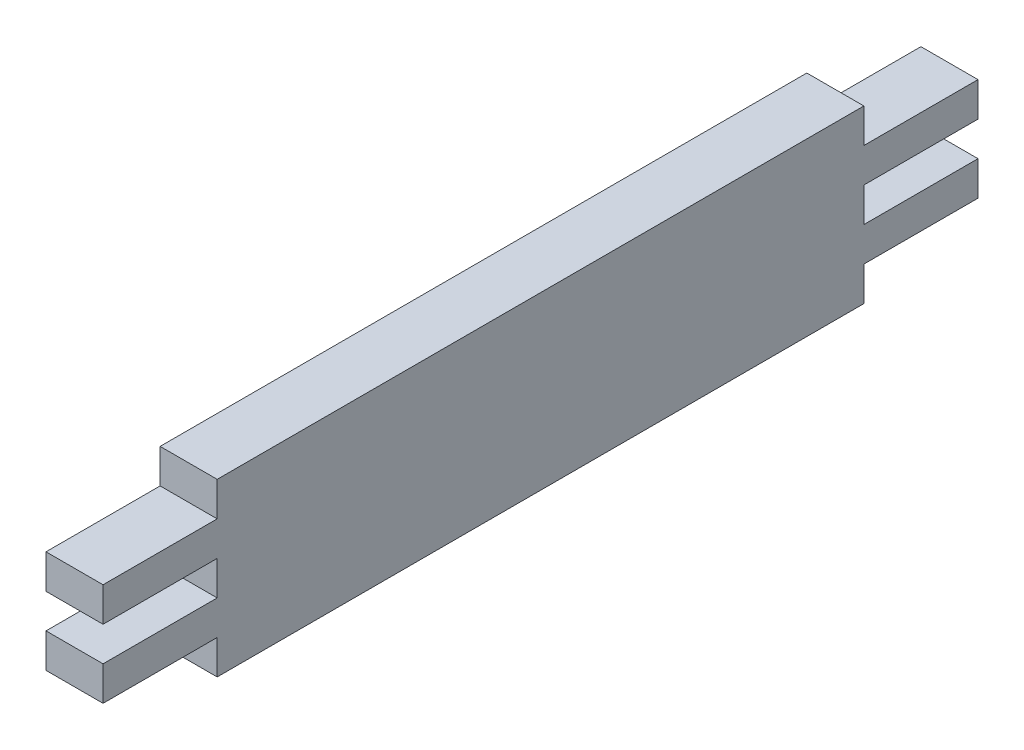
SolidWorks part; units mm, degrees
ref_plane "Front Plane" through (0, 0, 0) normal (0, 0, 1) x (1, 0, 0)
ref_plane "Top Plane" through (0, 0, 0) normal (0, 1, 0) x (1, 0, 0)
ref_plane "Right Plane" through (0, 0, 0) normal (1, 0, 0) x (0, 0, -1)
sketch "Sketch1" plane through (0, 0, 0) normal (1, 0, 0) x (0, 0, -1)
  line L1 (-23, -4.5) -> (23, -4.5)
  line L2 (-23, -4.5) -> (-23, 4.5)
  line L3 (-23, 4.5) -> (23, 4.5)
  line L4 (23, -4.5) -> (23, 4.5)
  line L5 (-23, -4.5) -> (23, 4.5) construction
  line L6 (-23, 4.5) -> (23, -4.5) construction
  point P0 (0, 0)
  dimension "D1" = 9
  dimension "D2" = 46
extrude "Boss-Extrude1" add sketch "Sketch1" along normal blind 3
sketch "Sketch2" plane through (0, 0, 0) normal (-1, 0, 0) x (0, 0, 1)
  line L0 (-23, -4.5) -> (-23, 4.5) construction
  line L1 (-23, 4.5) -> (-17, 4.5)
  line L2 (-23, 4.5) -> (-23, 2.7)
  line L3 (-23, 2.7) -> (-17, 2.7)
  line L4 (-17, 4.5) -> (-17, 2.7)
  line L5 (-23, 4.5) -> (23, 4.5) construction
  line L6 (-23, 0.9) -> (-17, 0.9)
  line L7 (-23, 0.9) -> (-23, -0.9)
  line L8 (-23, -0.9) -> (-17, -0.9)
  line L9 (-17, 0.9) -> (-17, -0.9)
  line L10 (-23, -2.7) -> (-17, -2.7)
  line L11 (-23, -2.7) -> (-23, -4.5)
  line L12 (-23, -4.5) -> (-17, -4.5)
  line L13 (-17, -2.7) -> (-17, -4.5)
  line L14 (17, 4.5) -> (23, 4.5)
  line L15 (17, 4.5) -> (17, 2.7)
  line L16 (17, 2.7) -> (23, 2.7)
  line L17 (23, 4.5) -> (23, 2.7)
  line L18 (17, 0.9) -> (23, 0.9)
  line L19 (17, 0.9) -> (17, -0.9)
  line L20 (17, -0.9) -> (23, -0.9)
  line L21 (23, 0.9) -> (23, -0.9)
  line L22 (17, -2.7) -> (23, -2.7)
  line L23 (17, -2.7) -> (17, -4.5)
  line L24 (17, -4.5) -> (23, -4.5)
  line L25 (23, -2.7) -> (23, -4.5)
  line L26 (23, -4.5) -> (-23, -4.5) construction
  line L27 (23, 4.5) -> (23, -4.5) construction
  dimension "D1" = 1.8
  dimension "D2" = 6
  dimension "D3" = 3
  dimension "D4" = 2
extrude "Cut-Extrude1" cut sketch "Sketch2" against normal blind 10
